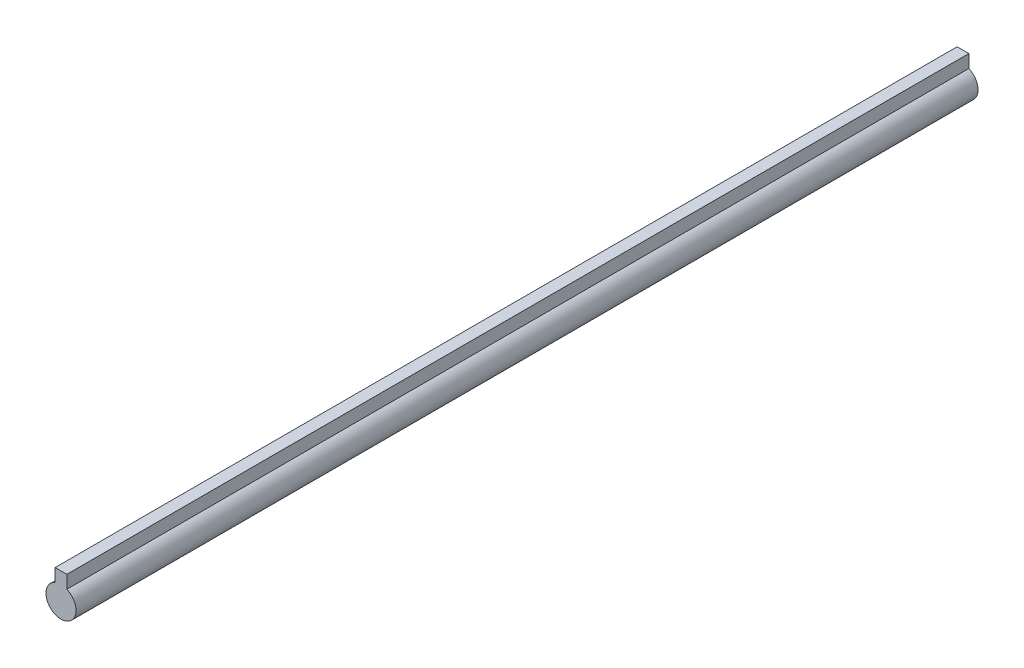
SolidWorks part; units mm, degrees
ref_plane "Front Plane" through (0, 0, 0) normal (0, 0, 1) x (1, 0, 0)
ref_plane "Top Plane" through (0, 0, 0) normal (0, 1, 0) x (1, 0, 0)
ref_plane "Right Plane" through (0, 0, 0) normal (1, 0, 0) x (0, 0, -1)
sketch "Sketch2" plane through (0, 0, 0) normal (0, 0, 1) x (1, 0, 0)
  line L8 (1.075, 4.9) -> (1.075, 2.5312)
  line L15 (1.075, 4.9) -> (-1.075, 4.9)
  line L16 (-1.075, 2.5312) -> (-1.075, 4.9)
  line L17 (0, 2.75) -> (1.9749, 2.75) construction
  arc A3 (-1.075, 2.5312) -> (1.075, 2.5312) centre (0, 0) ccw
  dimension "D1" = 5.5
  dimension "D2" = 2.15
  dimension "D3" = 2.15
extrude "Boss-Extrude1" add sketch "Sketch2" against normal blind 165
